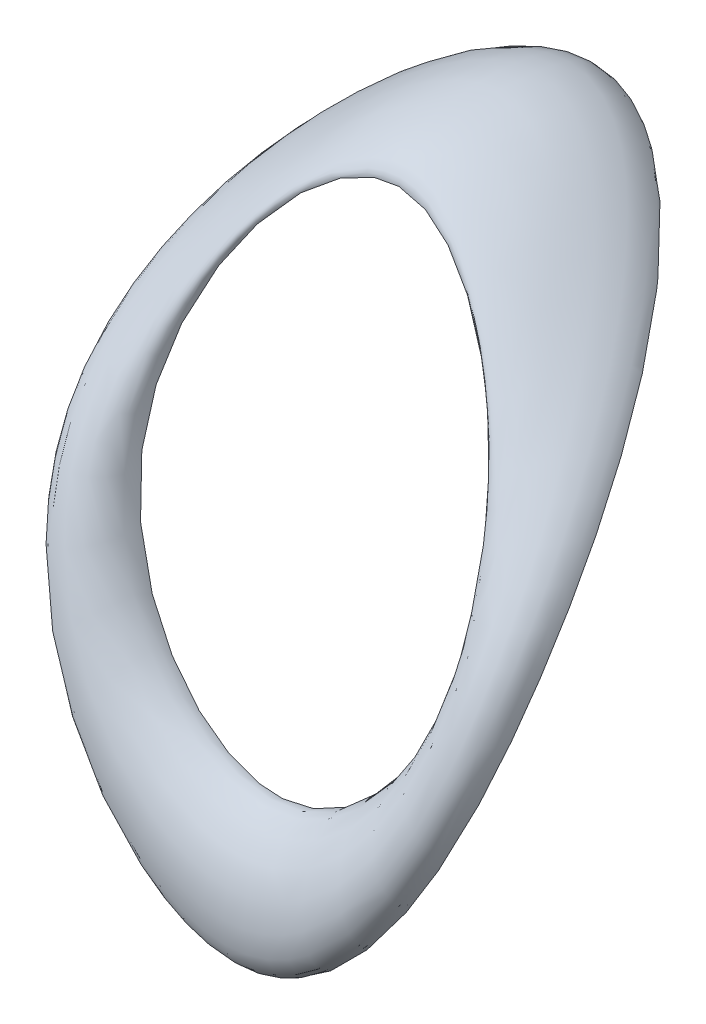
SolidWorks part; units mm, degrees
ref_plane "Front Plane" through (0, 0, 0) normal (0, 0, 1) x (1, 0, 0)
ref_plane "Top Plane" through (0, 0, 0) normal (0, 1, 0) x (1, 0, 0)
ref_plane "Right Plane" through (0, 0, 0) normal (1, 0, 0) x (0, 0, -1)
sketch "Sketch1" plane through (0, 0, 0) normal (0, 0, 1) x (1, 0, 0)
  ellipse E0 centre (0, 0) end of major axis (0, 100) minor radius 75
  dimension "D1" = 200
  dimension "D2" = 150
sketch "Sketch2" plane through (0, 0, 0) normal (1, 0, 0) x (0, 0, -1)
  line L0 (0, -100) -> (-90, -100) construction
  line L1 (0, 100) -> (0, -100) construction
  arc A0 (0, 100) -> (-90, -100) centre (164.9401, -94.473) ccw
  dimension "D1" = 255
  dimension "D2" = 90
curve "Curve1"
sketch "Sketch3" plane through (0, 0, 0) normal (0, 1, 0) x (1, 0, 0)
  line L0 (-87.5001, -71.9116) -> (-62.5001, -71.9119)
  line L1 (62.4999, -71.9134) -> (87.4999, -71.9136)
  arc A0 (62.4999, -71.9134) -> (87.4999, -71.9136) centre (74.9999, -71.9136) ccw
  arc A1 (-87.5001, -71.9116) -> (-62.5001, -71.9119) centre (-75.0001, -71.9116) ccw
  dimension "D1" = 25
sketch "Sketch4" plane through (0, 0, 0) normal (1, 0, 0) x (0, 0, -1)
  line L0 (-83.5295, -75.8519) -> (-96.4705, -124.1481)
  line L1 (-37.5, 100) -> (37.5, 100)
  line L2 (0, 0) -> (0, -119.4612) construction
  ellipse E0 centre (0, 100) end of major axis (37.5, 100) minor radius 12.5 (37.5, 100) -> (-37.5, 100) ccw
  ellipse E1 centre (-90, -100) end of major axis (-83.5295, -75.8519) minor radius 12.5 (-83.5295, -75.8519) -> (-96.4705, -124.1481) ccw
  dimension "D1" = 50
  dimension "D2" = 75
  dimension "D3" = 12.5
  dimension "D4" = 12.5
  dimension "D5" = 15
loft "Loft1" add
shell "Shell1" thickness 1.25
